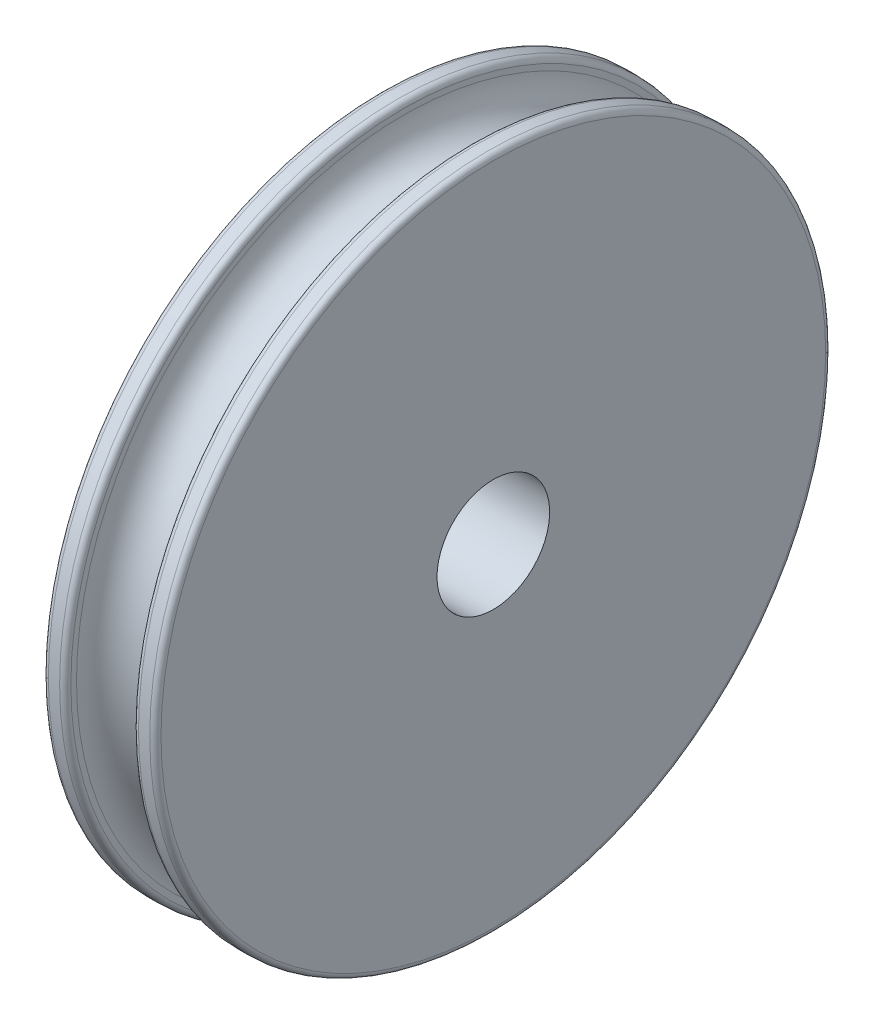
SolidWorks part; units mm, degrees
ref_plane "Plan de face" through (0, 0, 0) normal (0, 0, 1) x (1, 0, 0)
ref_plane "Plan de dessus" through (0, 0, 0) normal (0, 1, 0) x (1, 0, 0)
ref_plane "Plan de droite" through (0, 0, 0) normal (1, 0, 0) x (0, 0, -1)
sketch "Esquisse1" plane through (0, 0, 0) normal (0, 0, 1) x (1, 0, 0)
  line L0 (-15.1557, 0) -> (14.7812, 0) construction
  line L1 (0, 29) -> (0, -30) construction
  line L2 (-5, 0) -> (-5, 29.5)
  line L3 (-4.5, 30) -> (-3.5, 30)
  line L4 (-3, 29) -> (-3, 29.5)
  line L5 (3, 29) -> (3, 29.5)
  line L6 (4.5, 30) -> (3.5, 30)
  line L7 (5, 0) -> (5, 29.5)
  line L8 (-5, 0) -> (5, 0)
  arc A0 (-3, 29) -> (3, 29) centre (0, 29) ccw
  arc A1 (-5, 29.5) -> (-4.5, 30) centre (-4.5, 29.5) cw
  arc A2 (-3.5, 30) -> (-3, 29.5) centre (-3.5, 29.5) cw
  arc A3 (3.5, 30) -> (3, 29.5) centre (3.5, 29.5) ccw
  arc A4 (5, 29.5) -> (4.5, 30) centre (4.5, 29.5) ccw
  point P11 (-5, 30)
  point P22 (5, 30)
  point P23 (0, 26)
  dimension "D3" = 3
  dimension "D5" = 0.5
  dimension "D1" = 30
  dimension "D2" = 5
  dimension "D4" = 26
revolve "Révolution1" add sketch "Esquisse1" angle 360 about L0
sketch "Esquisse2" plane through (-5, 0, 0) normal (-1, 0, 0) x (0, 0, 1)
  circle A0 centre (0, 0) radius 5
  dimension "D1" = 10
extrude "Enlèv. mat.-Extru.1" cut sketch "Esquisse2" against normal blind 10
sketch "Esquisse3" plane through (0, 0, 0) normal (1, 0, 0) x (0, 0, -1)
  circle A0 centre (0, 0) radius 26
  dimension "D1" = 52
sketch "Esquisse4" plane through (-5, 0, 0) normal (-1, 0, 0) x (0, 0, 1)
  circle A0 centre (0, 20) radius 2
  dimension "D1" = 4
  dimension "D2" = 20
extrude "Boss.-Extru.1" add sketch "Esquisse4" along normal blind 2
